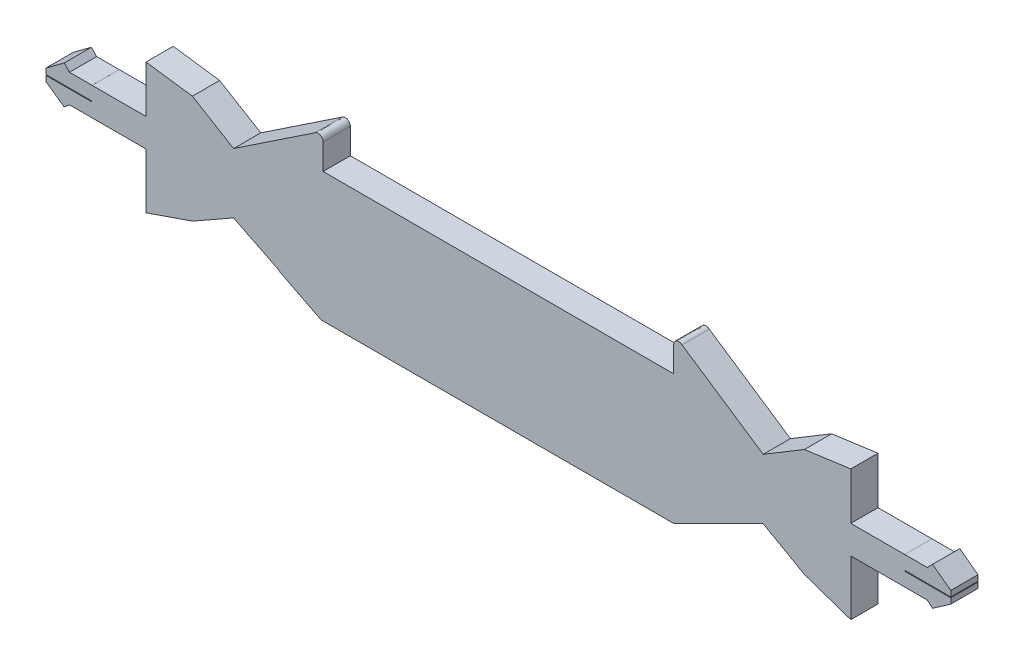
SolidWorks part; units mm, degrees
ref_plane "Alzado" through (0, 0, 0) normal (0, 0, 1) x (1, 0, 0)
ref_plane "Planta" through (0, 0, 0) normal (0, 1, 0) x (1, 0, 0)
ref_plane "Vista lateral" through (0, 0, 0) normal (1, 0, 0) x (0, 0, -1)
sketch "Croquis2" plane through (0, 0, 0) normal (0, 0, 1) x (1, 0, 0)
sketch_block_instance "F1 CAR CUT corte-1"
sketch_block "Bloque1"
extrude "Saliente-Extruir1" add sketch "Croquis2" along normal blind 3
delete or keep bodies "Sólido-Eliminar/Conservar 27" type delete bodies bodies 109 105 110 106 111 107
delete or keep bodies "Sólido-Eliminar/Conservar 33" type delete bodies bodies 102 101 103 108
delete or keep bodies "Sólido-Eliminar/Conservar 34" type delete bodies bodies 112 104 114
